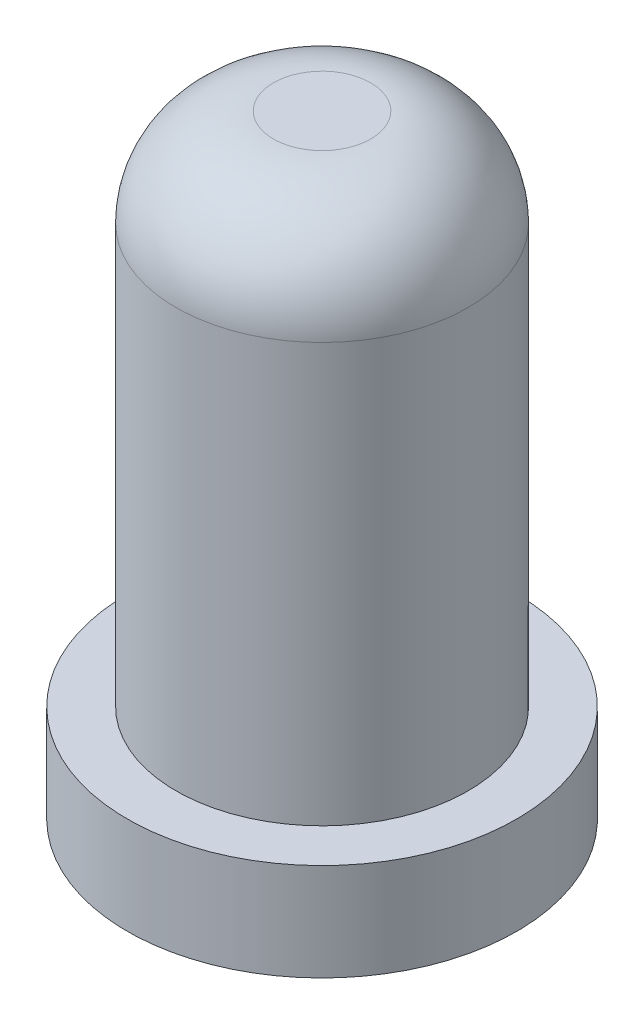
SolidWorks part; units mm, degrees
ref_plane "Front Plane" through (0, 0, 0) normal (0, 0, 1) x (1, 0, 0)
ref_plane "Top Plane" through (0, 0, 0) normal (0, 1, 0) x (1, 0, 0)
ref_plane "Right Plane" through (0, 0, 0) normal (1, 0, 0) x (0, 0, -1)
sketch "Sketch1" plane through (0, 0, 0) normal (0, 0, 1) x (1, 0, 0)
  line L0 (0, 0) -> (0, 2.3929) construction
  line L1 (0, 0) -> (0, 3)
  line L2 (0, 3) -> (-0.25, 3)
  line L4 (-0.75, 2.5) -> (-0.75, 0.35)
  line L5 (-0.75, 0.35) -> (-1, 0.35)
  line L6 (-1, 0.35) -> (-1, -0.15)
  line L7 (-1, -0.15) -> (-0.75, -0.15)
  line L8 (-0.75, -0.15) -> (-0.75, 0)
  line L9 (-0.75, 0) -> (0, 0)
  arc A0 (-0.25, 3) -> (-0.75, 2.5) centre (-0.25, 2.5) ccw
  dimension "D7" = 0.5
  dimension "D1" = 3
  dimension "D2" = 0.75
  dimension "D3" = 0.75
  dimension "D4" = 0.5
  dimension "D5" = 0.25
  dimension "D6" = 0.15
revolve "Revolve1" add sketch "Sketch1" angle 360 about L0
